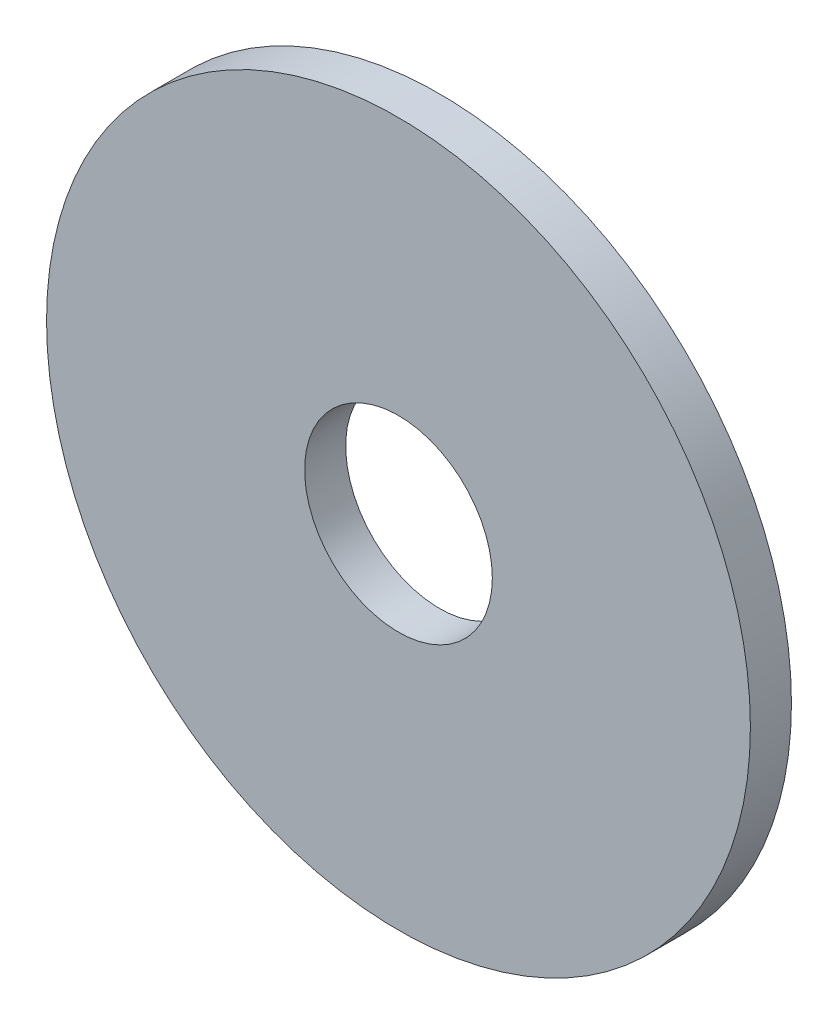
SolidWorks part; units mm, degrees
ref_plane "Plan de face" through (0, 0, 0) normal (0, 0, 1) x (1, 0, 0)
ref_plane "Plan de dessus" through (0, 0, 0) normal (0, 1, 0) x (1, 0, 0)
ref_plane "Plan de droite" through (0, 0, 0) normal (1, 0, 0) x (0, 0, -1)
sketch "Esquisse1" plane through (0, 0, 0) normal (0, 0, 1) x (1, 0, 0)
  line L0 (-59.3709, 0) -> (63.713, 0) construction
  line L1 (0, 55.3627) -> (0, -66.3852) construction
  circle A0 centre (0, 0) radius 1.6
  circle A1 centre (0, 0) radius 6
extrude "Extrusion1" add sketch "Esquisse1" along normal blind 0.7
